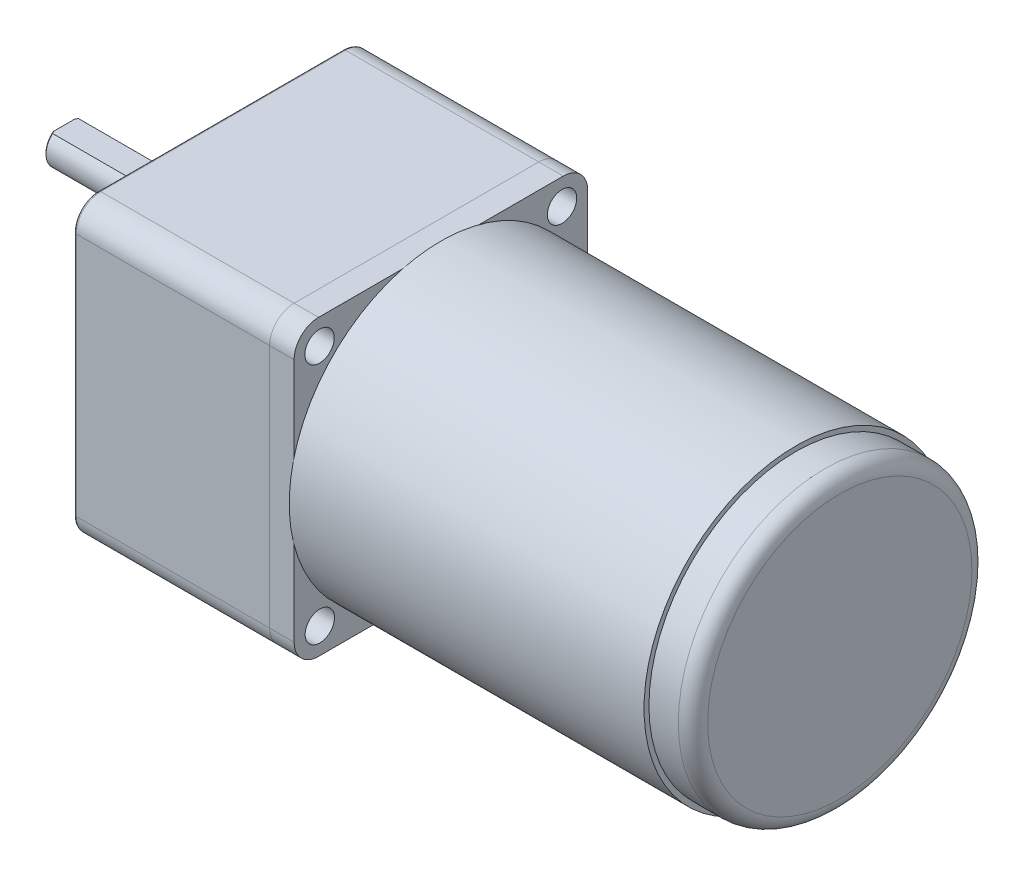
SolidWorks part; units mm, degrees
ref_plane "前视基准面" through (0, 0, 0) normal (0, 0, 1) x (1, 0, 0)
ref_plane "上视基准面" through (0, 0, 0) normal (0, 1, 0) x (1, 0, 0)
ref_plane "右视基准面" through (0, 0, 0) normal (1, 0, 0) x (0, 0, -1)
sketch "草图1" plane through (0, 0, 0) normal (1, 0, 0) x (0, 0, -1)
  line L1 (-25, -30) -> (25, -30)
  line L2 (-30, -25) -> (-30, 25)
  line L3 (-25, 30) -> (25, 30)
  line L4 (30, -25) -> (30, 25)
  line L5 (-30, -30) -> (30, 30) construction
  line L6 (-30, 30) -> (30, -30) construction
  arc A0 (-25, -30) -> (-30, -25) centre (-25, -25) cw
  arc A1 (25, -30) -> (30, -25) centre (25, -25) ccw
  arc A2 (25, 30) -> (30, 25) centre (25, 25) cw
  arc A3 (-30, 25) -> (-25, 30) centre (-25, 25) cw
  point P0 (0, 0)
  dimension "D1" = 5
extrude "凸台-拉伸1" add sketch "草图1" along normal blind 40
sketch "草图2" plane through (40, 0, 0) normal (1, 0, 0) x (0, 0, -1)
  line L0 (25, 30) -> (-25, 30) construction
  line L1 (-25, -30) -> (25, -30)
  line L2 (-30, -25) -> (-30, 25)
  line L3 (-25, 30) -> (25, 30)
  line L4 (30, -25) -> (30, 25)
  line L5 (-30, -30) -> (30, 30) construction
  line L6 (-30, 30) -> (30, -30) construction
  arc A0 (25, 30) -> (30, 25) centre (25, 25) cw
  arc A1 (25, -30) -> (30, -25) centre (25, -25) ccw
  arc A2 (-25, -30) -> (-30, -25) centre (-25, -25) cw
  arc A3 (-30, 25) -> (-25, 30) centre (-25, 25) cw
  point P0 (0, 0)
  dimension "D1" = 5
extrude "凸台-拉伸2" add sketch "草图2" along normal blind 5 separate body
sketch "草图5" plane through (0, 0, 0) normal (-1, 0, 0) x (0, 0, 1)
  circle A0 centre (0, 10) radius 12
extrude "凸台-拉伸5" add sketch "草图5" along normal blind 3 separate body
sketch "草图6" plane through (-3, 0, 0) normal (-1, 0, 0) x (0, 0, 1)
  circle A0 centre (0, 10) radius 4
extrude "凸台-拉伸6" add sketch "草图6" along normal blind 29 separate body
fillet "圆角2" radius 0.5 1 edges at (-3, 10, 12)
sketch "草图7" plane through (-32, 0, 0) normal (-1, 0, 0) x (0, 0, 1)
  line L2 (2.6458, 13) -> (-2.6458, 13)
  arc A0 (2.6458, 13) -> (-2.6458, 13) centre (0, 10) ccw
extrude "切除-拉伸1" cut sketch "草图7" against normal blind 25
chamfer "倒角1" distance 0.3 angle 45 1 edges at (-32, 6, 0)
sketch "草图8" plane through (0, 0, 0) normal (-1, 0, 0) x (0, 0, 1)
  circle A0 centre (0, 0) radius 26.3
extrude "切除-拉伸2" cut sketch "草图8" against normal blind 0.5
fillet "圆角3" radius 0.5 1 edges at (0, 0, 26.3)
fillet "圆角4" radius 0.5 8 edges at (0, -30, 0) (0, -28.5355, -28.5355) (0, 0, -30) (0, 28.5355, -28.5355) (0, 30, 0) (0, 28.5355, 28.5355) (0, 0, 30) (0, -28.5355, 28.5355)
sketch "草图9" plane through (0, 0, 0) normal (-1, 0, 0) x (0, 0, 1)
  point P19 (-24.7487, 24.7487)
  point P20 (24.7487, 24.7487)
  point P21 (24.7487, -24.7487)
  point P22 (-24.7487, -24.7487)
hole_wizard "M4 螺纹孔1" positions "3D草图1" profile "草图10" tap size "M4" standard "GB"
sketch3d "3D草图1"
  point P0 (0, 24.7487, -24.7487)
  point P3 (0, 24.7487, 24.7487)
  point P6 (0, -24.7487, 24.7487)
  point P9 (0, -24.7487, -24.7487)
sketch "草图10" plane through (0, 24.7487, -24.7487) normal (0, 1, 0) x (0, 0, 1)
  line L0 (0, 0) -> (0, 12.9914)
  line L1 (0, 12.9914) -> (1.65, 12)
  line L2 (1.65, 12) -> (1.65, 0)
  line L5 (1.65, 0) -> (0, 0)
  line L10 (0, 12.9914) -> (-1.65, 12) construction
  line L11 (0, -6.35) -> (0, 107.95) construction
  dimension "螺纹孔钻头直径" = 3.3
  dimension "螺纹孔钻头深度" = 12
  dimension "导头角度" = 118
sketch "草图11" plane through (45, 0, 0) normal (1, 0, 0) x (0, 0, -1)
  circle A5 centre (-24.8007, 24.8007) radius 3
  circle A6 centre (24.7487, 24.7487) radius 3
  circle A7 centre (24.7487, -24.7487) radius 3
  circle A8 centre (-24.7487, -24.7487) radius 3
extrude "切除-拉伸3" cut sketch "草图11" against normal blind 33
sketch "草图12" plane through (45, 0, 0) normal (1, 0, 0) x (0, 0, -1)
  circle A0 centre (0, 0) radius 31
extrude "凸台-拉伸7" add sketch "草图12" along normal blind 72.5 separate body
sketch "草图13" plane through (117.5, 0, 0) normal (1, 0, 0) x (0, 0, -1)
  circle A0 centre (0, 0) radius 30
extrude "凸台-拉伸8" add sketch "草图13" along normal blind 9 separate body
fillet "圆角5" radius 3 1 edges at (126.5, 0, -30)
